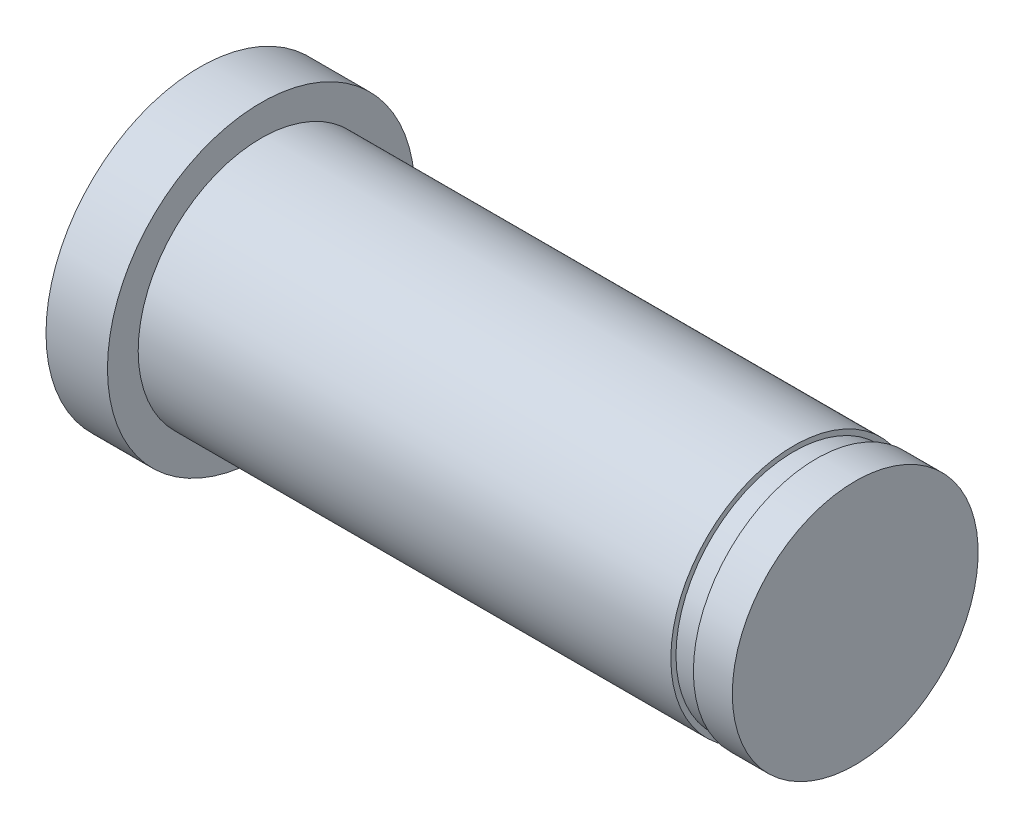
SolidWorks part; units mm, degrees
ref_plane "Face" through (0, 0, 0) normal (0, 0, 1) x (1, 0, 0)
ref_plane "Dessus" through (0, 0, 0) normal (0, 1, 0) x (1, 0, 0)
ref_plane "Droite" through (0, 0, 0) normal (1, 0, 0) x (0, 0, -1)
sketch "Esquisse1" plane through (0, 0, 0) normal (0, 0, 1) x (1, 0, 0)
  line L0 (0, 0) -> (0, 7.5)
  line L1 (0, 7.5) -> (3, 7.5)
  line L2 (3, 7.5) -> (3, 6)
  line L3 (3, 6) -> (29, 6)
  line L4 (32, 6) -> (32, 0)
  line L5 (32, 0) -> (0, 0)
  line L6 (0, 0) -> (39.4026, 0) construction
  line L7 (30.1, 6) -> (32, 6)
  line L9 (29, 6) -> (29, 5.75)
  line L10 (29, 5.75) -> (30.1, 5.75)
  line L11 (30.1, 6) -> (30.1, 5.75)
  dimension "D1" = 3
  dimension "D2" = 32
  dimension "D3" = 26
  dimension "D4" = 1.1
  dimension "D5" = 15
  dimension "D6" = 12
  dimension "D7" = 11.5
revolve "Base-Révolution" add sketch "Esquisse1" angle 360 about L6
